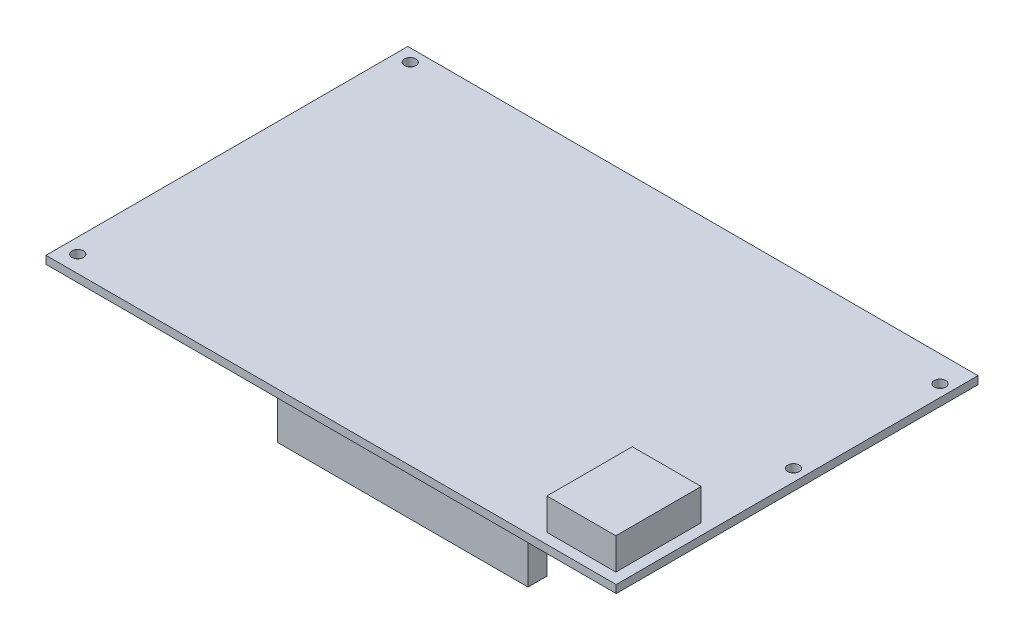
SolidWorks part; units mm, degrees
ref_plane "Front Plane" through (0, 0, 0) normal (0, 0, 1) x (1, 0, 0)
ref_plane "Top Plane" through (0, 0, 0) normal (0, 1, 0) x (1, 0, 0)
ref_plane "Right Plane" through (0, 0, 0) normal (1, 0, 0) x (0, 0, -1)
sketch "Sketch1" plane through (0, 0, 0) normal (0, 1, 0) x (1, 0, 0)
  line L1 (0, 0) -> (145.9357, 0)
  line L2 (0, 0) -> (0, 92.5957)
  line L3 (0, 92.5957) -> (145.9357, 92.5957)
  line L4 (145.9357, 0) -> (145.9357, 92.5957)
  circle A0 centre (3.81, 89.408) radius 1.4732
  circle A1 centre (3.81, 4.318) radius 1.4732
  circle A2 centre (142.875, 85.9155) radius 1.4732
  circle A3 centre (142.875, 48.4505) radius 1.4732
  dimension "D3" = 2.9464
  dimension "D1" = 145.9357
  dimension "D2" = 92.5957
  dimension "D4" = 3.81
  dimension "D5" = 89.408
  dimension "D6" = 4.318
  dimension "D7" = 142.875
  dimension "D8" = 85.9155
  dimension "D9" = 48.4505
extrude "Extrude1" add sketch "Sketch1" along normal blind 2.0066
sketch "Sketch2" plane through (0, 2.0066, 0) normal (0, 1, 0) x (-1, 0, 0)
  line L0 (-145.9357, 0) -> (-145.9357, -92.5957) construction
  line L1 (-125.4887, -24.5491) -> (-143.129, -24.5491)
  line L2 (-125.4887, -24.5491) -> (-125.4887, -2.7051)
  line L3 (-125.4887, -2.7051) -> (-143.129, -2.7051)
  line L4 (-143.129, -24.5491) -> (-143.129, -2.7051)
  line L5 (0, 0) -> (-145.9357, 0) construction
  dimension "D1" = 2.8067
  dimension "D2" = 2.7051
  dimension "D3" = 17.6403
  dimension "D4" = 21.844
extrude "Extrude2" add sketch "Sketch2" along normal blind 8.0518
sketch "Sketch3" plane through (0, 0, 0) normal (0, -1, 0) x (1, 0, 0)
  line L0 (145.9357, 0) -> (145.9357, -92.5957) construction
  line L1 (57.8866, -1.397) -> (121.9708, -1.397)
  line L2 (57.8866, -1.397) -> (57.8866, -6.2357)
  line L3 (57.8866, -6.2357) -> (121.9708, -6.2357)
  line L4 (121.9708, -1.397) -> (121.9708, -6.2357)
  line L5 (0, 0) -> (145.9357, 0) construction
  dimension "D1" = 23.9649
  dimension "D2" = 64.0842
  dimension "D3" = 1.397
  dimension "D4" = 4.8387
extrude "Extrude3" add sketch "Sketch3" along normal blind 11.2395
